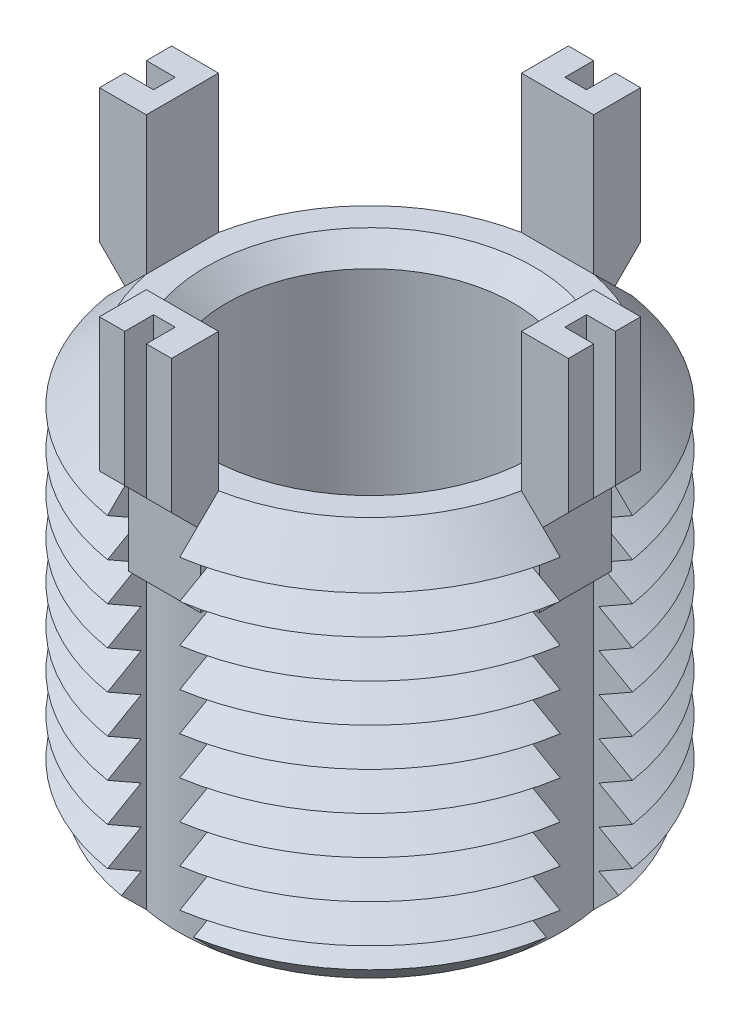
SolidWorks part; units mm, degrees
ref_plane "Front Plane" through (0, 0, 0) normal (0, 0, 1) x (1, 0, 0)
ref_plane "Top Plane" through (0, 0, 0) normal (0, 1, 0) x (1, 0, 0)
ref_plane "Right Plane" through (0, 0, 0) normal (1, 0, 0) x (0, 0, -1)
sketch "Sketch1" plane through (0, 0, 0) normal (0, 1, 0) x (1, 0, 0)
  circle A0 centre (0, 0) radius 12.7
  dimension "D1" = 25.4
extrude "Boss-Extrude1" add sketch "Sketch1" against normal blind 22.098
chamfer "Chamfer1" distance 2.117 angle 45 2 edges at (0, -22.098, 12.7) (0, 0, 12.7)
sketch "Sketch2" plane through (0, 0, 0) normal (1, 0, 0) x (0, 0, -1)
  line L0 (0, 0.8859) -> (0, -9.2617) construction
sketch "Sketch3" plane through (0, 0, 0) normal (1, 0, 0) x (0, 0, -1)
  line L0 (-12.7, -2.117) -> (-10.8666, -3.1755)
  line L1 (-10.8666, -3.1755) -> (-12.7, -4.234)
  line L2 (-12.7, -2.117) -> (-12.7, -19.981) construction
  line L3 (-12.7, -4.234) -> (-12.7, -2.117)
  dimension "D1" = 2.117
revolve "Cut-Revolve1" cut sketch "Sketch3" angle 360 about L0
pattern_linear "LPattern1" count 9 spacing 2.117 along (0, -1, 0) of "Cut-Revolve1"
sketch "Sketch4" plane through (0, 0, 0) normal (0, 1, 0) x (1, 0, 0)
  line L0 (-10.3923, 2) -> (-12.5415, 2)
  line L2 (-12.5415, -2) -> (-10.3923, -2)
  arc A0 (-10.3923, 2) -> (-10.3923, -2) centre (0, 0) ccw
  arc A1 (-12.5415, 2) -> (-12.5415, -2) centre (0, 0) ccw
  circle A2 centre (0, 0) radius 12.7 construction
  circle A3 centre (0, 0) radius 10.583 construction
  point P1 (-10.583, 0)
  point P3 (-12.7, 0)
  point P13 (0, 0)
  dimension "D1" = 4
extrude "Cut-Extrude1" cut sketch "Sketch4" against normal up to surface (22.098 mm away)
pattern_circular "CirPattern1" count 4 over 360 about axis through (0, 0, 0) along (0, 1, 0) of "Cut-Extrude1"
sketch "Sketch5" plane through (0, 0, 0) normal (1, 0, 0) x (0, 0, -1)
  line L0 (-10.3923, 7.649) -> (-10.3923, -5.351)
  line L1 (-10.3923, -5.351) -> (-11.3923, -5.351)
  line L2 (-11.3923, -5.351) -> (-11.3923, -1.351)
  line L3 (-11.3923, -1.351) -> (-12.9923, 0.249)
  line L4 (-12.9923, 0.249) -> (-12.9923, 7.649)
  line L5 (-12.9923, 7.649) -> (-10.3923, 7.649)
  line L6 (-12.5415, -6.351) -> (-2, -6.351) construction
  point P9 (-2, 0)
  point P10 (-11.3923, -1.351)
  dimension "D1" = 1
  dimension "D2" = 13
  dimension "D3" = 9
  dimension "D4" = 2.6
  dimension "D5" = 1
  dimension "D6" = 45
extrude "Boss-Extrude3" add sketch "Sketch5" along normal mid plane 4
pattern_circular "CirPattern2" count 4 over 360 about axis through (0, 0, 0) along (0, 1, 0) of "Boss-Extrude3"
sketch "Sketch6" plane through (0, 7.649, 0) normal (0, 1, 0) x (1, 0, 0)
  line L0 (-12.9923, -2) -> (-12.9923, 2) construction
  line L1 (-12.9923, -0.6) -> (-11.3923, -0.6)
  line L2 (-12.9923, -0.6) -> (-12.9923, 0.6)
  line L3 (-12.9923, 0.6) -> (-11.3923, 0.6)
  line L4 (-11.3923, -0.6) -> (-11.3923, 0.6)
  line L5 (-12.9923, -0.6) -> (-11.3923, 0.6) construction
  line L6 (-12.9923, 0.6) -> (-11.3923, -0.6) construction
  line L7 (12.9923, 2) -> (12.9923, -2) construction
  line L8 (-0.6, 11.3923) -> (0.6, 11.3923)
  line L9 (-0.6, 11.3923) -> (-0.6, 12.9923)
  line L10 (-0.6, 12.9923) -> (0.6, 12.9923)
  line L11 (0.6, 11.3923) -> (0.6, 12.9923)
  line L12 (-0.6, 11.3923) -> (0.6, 12.9923) construction
  line L13 (-0.6, 12.9923) -> (0.6, 11.3923) construction
  line L14 (11.3923, -0.6) -> (12.9923, -0.6)
  line L15 (11.3923, -0.6) -> (11.3923, 0.6)
  line L16 (11.3923, 0.6) -> (12.9923, 0.6)
  line L17 (12.9923, -0.6) -> (12.9923, 0.6)
  line L18 (11.3923, -0.6) -> (12.9923, 0.6) construction
  line L19 (11.3923, 0.6) -> (12.9923, -0.6) construction
  line L20 (-0.6, -12.9923) -> (0.6, -12.9923)
  line L21 (-0.6, -12.9923) -> (-0.6, -11.3923)
  line L22 (-0.6, -11.3923) -> (0.6, -11.3923)
  line L23 (0.6, -12.9923) -> (0.6, -11.3923)
  line L24 (-0.6, -12.9923) -> (0.6, -11.3923) construction
  line L25 (-0.6, -11.3923) -> (0.6, -12.9923) construction
  line L26 (-2, 12.9923) -> (2, 12.9923) construction
  line L27 (2, -12.9923) -> (-2, -12.9923) construction
  point P0 (-12.1923, 0)
  point P7 (-12.9923, 0)
  point P8 (-12.9923, 0)
  point P9 (0, 12.1923)
  point P14 (12.1923, 0)
  point P19 (0, -12.1923)
  point P24 (0, 12.9923)
  point P25 (12.9923, 0)
  point P26 (12.9923, 0)
  point P27 (0, 12.9923)
  point P30 (0, -12.9923)
  point P33 (0, -12.9923)
  dimension "D1" = 1.2
  dimension "D2" = 1.6
extrude "Cut-Extrude3" cut sketch "Sketch6" against normal through all both and the other way through all
sketch "Sketch7" plane through (0, 0, 0) normal (0, 1, 0) x (1, 0, 0)
  circle A0 centre (0, 0) radius 7.9375
  dimension "D1" = 15.875
extrude "Cut-Extrude4" cut sketch "Sketch7" against normal up to surface (22.098 mm away)
chamfer "Chamfer2" distance 1.1545 angle 45 2 edges at (0, 0, 7.9375) (0, -22.098, 7.9375)
